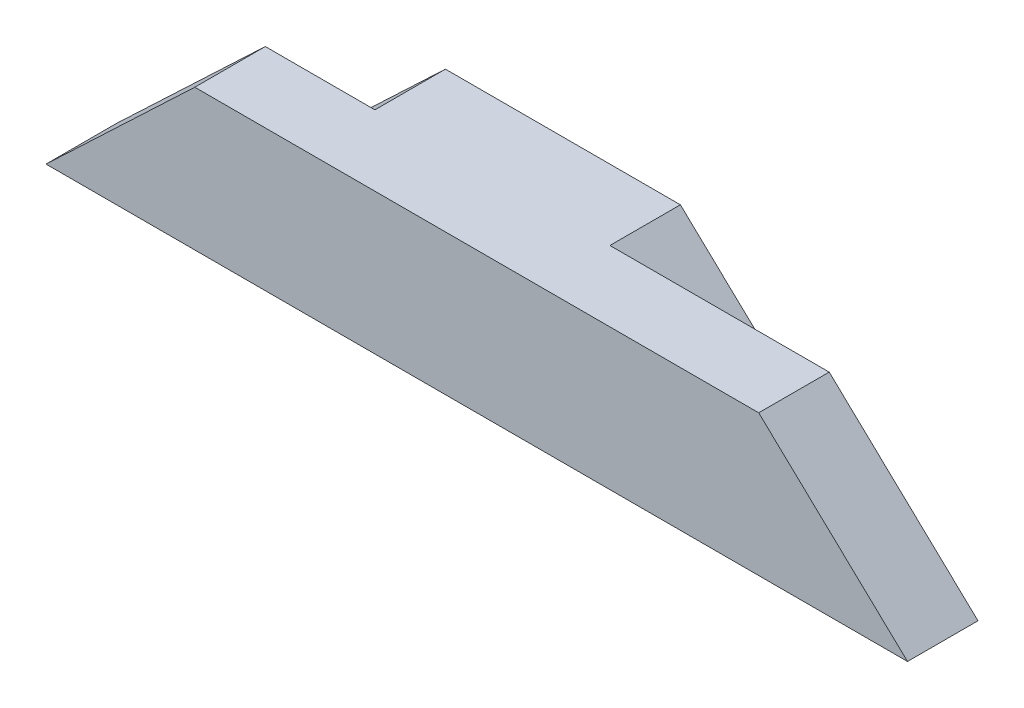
SolidWorks part; units mm, degrees
ref_plane "Plan de face" through (0, 0, 0) normal (0, 0, 1) x (1, 0, 0)
ref_plane "Plan de dessus" through (0, 0, 0) normal (0, 1, 0) x (1, 0, 0)
ref_plane "Plan de droite" through (0, 0, 0) normal (1, 0, 0) x (0, 0, -1)
sketch "Esquisse1" plane through (0, 0, 0) normal (0, 0, 1) x (1, 0, 0)
  line L1 (0, 0) -> (62, 0)
  line L2 (0, 0) -> (0, 9)
  line L3 (0, 9) -> (62, 9)
  line L4 (62, 0) -> (62, 9)
  dimension "D1" = 62
  dimension "D2" = 9
extrude "Extrusion1" add sketch "Esquisse1" along normal blind 9
sketch "Esquisse2" plane through (0, 0, 9) normal (0, 0, 1) x (1, 0, 0)
  line L0 (62, 9) -> (52.5, 9)
  line L1 (62, 9) -> (0, 9) construction
  line L2 (52.5, 9) -> (62, 0)
  line L3 (62, 0) -> (62, 9)
  line L4 (0, 9) -> (9.5, 9)
  line L5 (9.5, 9) -> (0, 0)
  line L6 (0, 0) -> (0, 9)
  dimension "D1" = 43
  dimension "D2" = 9.5
extrude "Enlèv. mat.-Extru.2" cut sketch "Esquisse2" against normal blind 9
sketch "Esquisse3" plane through (0, 0, 0) normal (0, 0, -1) x (-1, 0, 0)
  line L0 (-9.5, 9) -> (-23.5, 9)
  line L1 (-52.5, 9) -> (-9.5, 9) construction
  line L2 (-23.5, 9) -> (-14, 0)
  line L3 (0, 0) -> (-62, 0) construction
  line L4 (-14, 0) -> (0, 0)
  line L5 (0, 0) -> (-9.5, 9)
  line L6 (-52.5, 9) -> (-38.5, 9)
  line L7 (-38.5, 9) -> (-48, 0)
  line L8 (-48, 0) -> (-62, 0)
  line L9 (-62, 0) -> (-52.5, 9)
  dimension "D1" = 14
  dimension "D2" = 14
  dimension "D3" = 14
  dimension "D4" = 14
extrude "Enlèv. mat.-Extru.3" cut sketch "Esquisse3" against normal blind 4.5
sketch "Esquisse5" plane through (0, 0, 4.5) normal (0, 0, -1) x (-1, 0, 0)
  line L0 (-9.5, 9) -> (-16.5, 9)
  line L1 (-9.5, 9) -> (-23.5, 9) construction
  line L2 (-16.5, 9) -> (-7, 0)
  line L3 (-14, 0) -> (0, 0) construction
  line L4 (-7, 0) -> (0, 0)
  dimension "D1" = 7
  dimension "D2" = 7
extrude "Enlèv. mat.-Extru.4" cut sketch "Esquisse5" against normal through all and the other way through all
